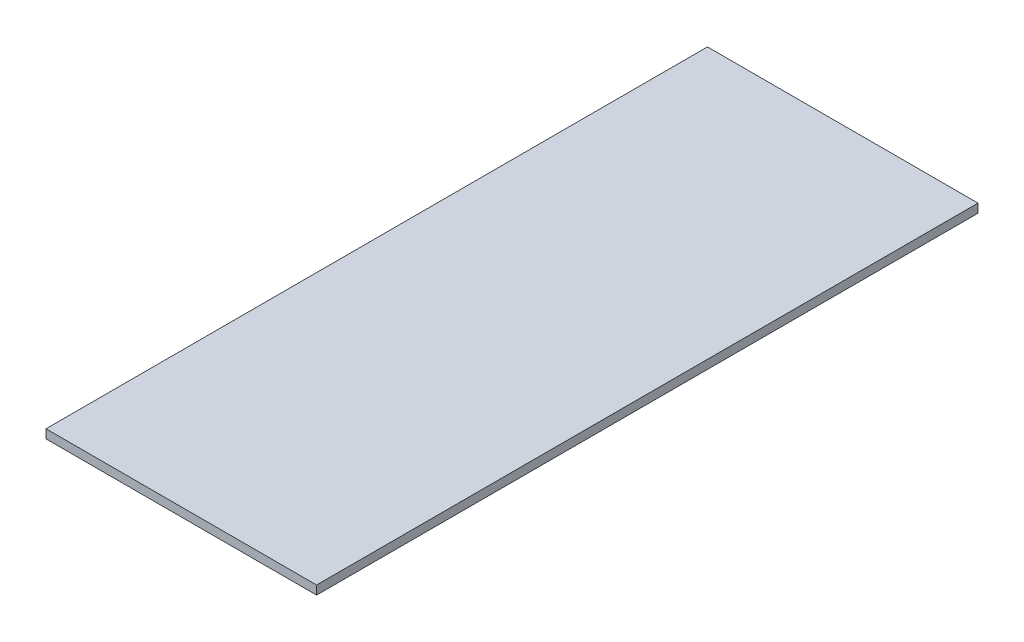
SolidWorks part; units mm, degrees
ref_plane "Front Plane" through (0, 0, 0) normal (0, 0, 1) x (1, 0, 0)
ref_plane "Top Plane" through (0, 0, 0) normal (0, 1, 0) x (1, 0, 0)
ref_plane "Right Plane" through (0, 0, 0) normal (1, 0, 0) x (0, 0, -1)
sketch "Sketch1" plane through (0, 0, 0) normal (0, 1, 0) x (1, 0, 0)
  line L1 (-85.725, 209.55) -> (85.725, 209.55)
  line L2 (-85.725, 209.55) -> (-85.725, -209.55)
  line L3 (-85.725, -209.55) -> (85.725, -209.55)
  line L4 (85.725, 209.55) -> (85.725, -209.55)
  line L5 (-85.725, 209.55) -> (85.725, -209.55) construction
  line L6 (-85.725, -209.55) -> (85.725, 209.55) construction
  point P0 (0, 0)
  dimension "D1" = 171.45
  dimension "D2" = 419.1
extrude "Boss-Extrude1" add sketch "Sketch1" along normal blind 5.5562
